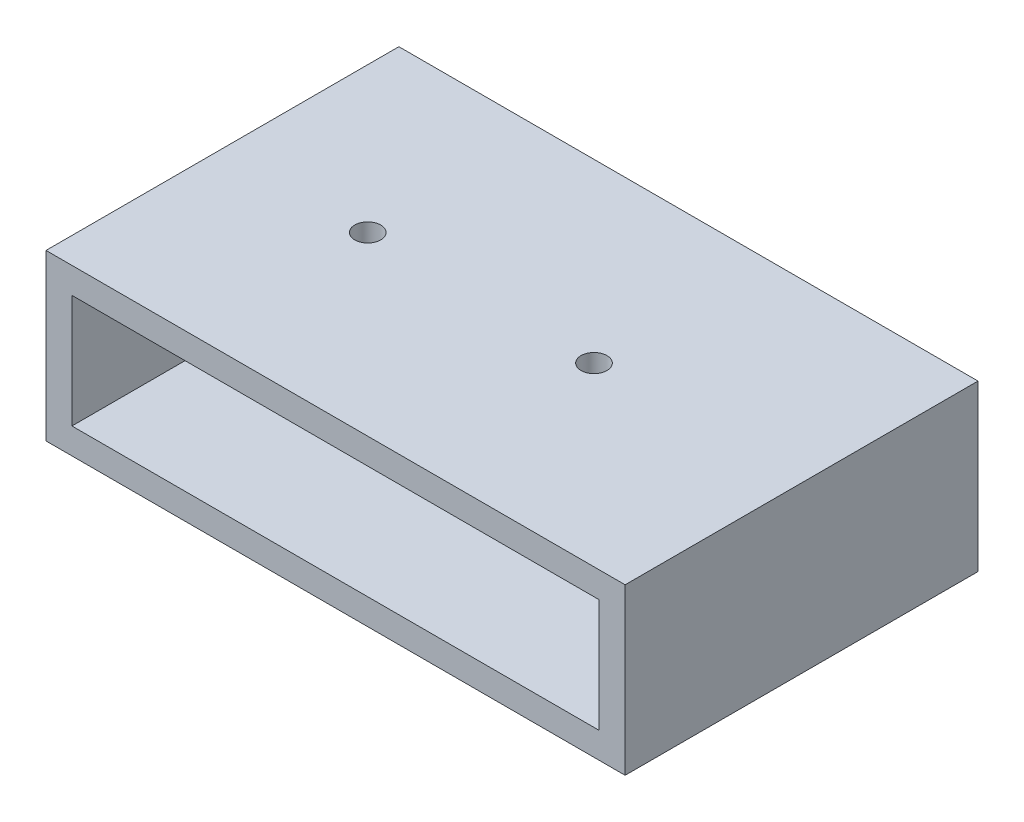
SolidWorks part; units mm, degrees
ref_plane "Front Plane" through (0, 0, 0) normal (0, 0, 1) x (1, 0, 0)
ref_plane "Top Plane" through (0, 0, 0) normal (0, 1, 0) x (1, 0, 0)
ref_plane "Right Plane" through (0, 0, 0) normal (1, 0, 0) x (0, 0, -1)
sketch "Sketch1" plane through (0, 0, 0) normal (0, 1, 0) x (1, 0, 0)
  line L3 (53.086, 0) -> (53.086, 21.59)
  line L4 (53.086, 21.59) -> (-17.78, 21.59)
  line L5 (-17.78, 21.59) -> (-17.78, 0)
  line L6 (-17.78, 0) -> (-17.78, -21.59)
  line L7 (-17.78, -21.59) -> (53.086, -21.59)
  line L8 (53.086, -21.59) -> (53.086, 0)
  circle A0 centre (0, 0) radius 1.5875
  circle A1 centre (27.686, 0) radius 1.5875
extrude "Boss-Extrude1" add sketch "Sketch1" along normal blind 3.175
sketch "Sketch2" plane through (0, 3.175, 0) normal (0, 1, 0) x (1, 0, 0)
  line L0 (-17.78, 21.59) -> (-14.605, 21.59)
  line L1 (53.086, 21.59) -> (-17.78, 21.59) construction
  line L2 (-14.605, 21.59) -> (-14.605, -21.59)
  line L3 (-17.78, -21.59) -> (53.086, -21.59) construction
  line L4 (-14.605, -21.59) -> (-17.78, -21.59)
  line L5 (-17.78, 21.59) -> (-17.78, -21.59) construction
  line L6 (-17.78, -21.59) -> (-17.78, 21.59)
extrude "Boss-Extrude2" add sketch "Sketch2" along normal blind 17.018
sketch "Sketch3" plane through (0, 3.175, 0) normal (0, 1, 0) x (1, 0, 0)
  line L0 (53.086, 21.59) -> (49.911, 21.59)
  line L1 (53.086, 21.59) -> (-14.605, 21.59) construction
  line L2 (49.911, 21.59) -> (49.911, -21.59)
  line L3 (-14.605, -21.59) -> (53.086, -21.59) construction
  line L4 (49.911, -21.59) -> (53.086, -21.59)
  line L5 (53.086, -21.59) -> (53.086, 21.59) construction
  line L6 (53.086, -21.59) -> (53.086, 21.59)
extrude "Boss-Extrude3" add sketch "Sketch3" along normal blind 17.018
sketch "Sketch4" plane through (0, 3.175, 0) normal (0, 1, 0) x (1, 0, 0)
  line L0 (-17.78, 21.59) -> (53.086, 21.59)
  line L1 (53.086, 21.59) -> (53.086, -21.59)
  line L2 (53.086, -21.59) -> (-17.78, -21.59)
  line L3 (-17.78, 21.59) -> (-17.78, -21.59) construction
  line L4 (-17.78, -21.59) -> (-14.605, -21.59) construction
  line L5 (-17.78, -21.59) -> (-17.78, 21.59)
extrude "Boss-Extrude4" add sketch "Sketch4" along normal blind 17.018
sketch "Sketch5" plane through (0, 3.175, 0) normal (0, -1, 0) x (1, 0, 0)
  circle A0 centre (0, 0) radius 1.5875
  circle A1 centre (27.686, 0) radius 1.5875
extrude "Cut-Extrude1" cut sketch "Sketch5" against normal blind 17.018
sketch "Sketch6" plane through (0, 0, 21.59) normal (0, 0, 1) x (1, 0, 0)
  line L2 (-14.605, 17.018) -> (-14.605, 3.175)
  line L4 (13.8116, 17.018) -> (-14.605, 17.018)
  line L5 (49.911, 17.018) -> (49.911, 3.175)
  line L6 (13.8116, 17.018) -> (49.911, 17.018)
  line L7 (17.653, 3.175) -> (-14.605, 3.175)
  line L8 (17.653, 3.175) -> (49.911, 3.175)
extrude "Cut-Extrude2" cut sketch "Sketch6" against normal blind 48.006
